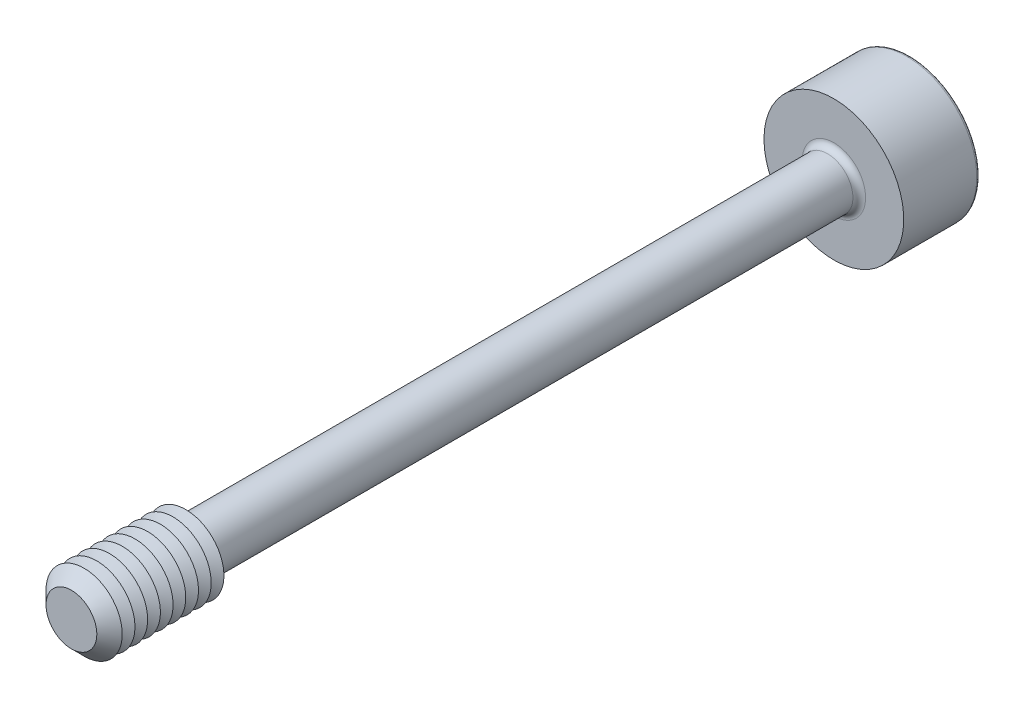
SolidWorks part; units mm, degrees
ref_plane "Front Plane" through (0, 0, 0) normal (0, 0, 1) x (1, 0, 0)
ref_plane "Top Plane" through (0, 0, 0) normal (0, 1, 0) x (1, 0, 0)
ref_plane "Right Plane" through (0, 0, 0) normal (1, 0, 0) x (0, 0, -1)
sketch "Sketch1" plane through (0, 0, 0) normal (0, 0, 1) x (1, 0, 0)
  circle A0 centre (0, 0) radius 1
  dimension "D1" = 2
extrude "Extrude1" add sketch "Sketch1" along normal mid plane 30
sketch "Sketch2" plane through (0, 0, 0) normal (1, 0, 0) x (0, 0, -1)
  line L0 (-15, 0) -> (-15, 1.5)
  line L1 (-15, 1) -> (-15, -1) construction
  line L2 (-15, 1.5) -> (-10.5, 1.5)
  line L3 (-10.5, 1.5) -> (-10.2113, 1)
  line L4 (15, 1) -> (-15, 1) construction
  line L5 (-10.2113, 1) -> (-10.2113, 0)
  line L6 (-10.2113, 0) -> (-15, 0)
  dimension "D1" = 1.5
  dimension "D2" = 120
  dimension "D3" = 4.5
revolve "Revolve1" add sketch "Sketch2" angle 360 about L6
chamfer "Chamfer1" distance 0.5 angle 45 1 edges at (0, 1.5, 15)
sketch "Sketch3" plane through (0, 0, -15) normal (0, 0, -1) x (-1, 0, 0)
  circle A0 centre (0, 0) radius 2.75
  dimension "D1" = 5.5
extrude "Extrude2" add sketch "Sketch3" along normal blind 3
sketch "Sketch4" plane through (-13.7, 0, -18) normal (0, 0, 1) x (1, 0, 0)
  line L2 (12.9783, -1.25) -> (14.4217, -1.25)
  line L3 (14.4217, -1.25) -> (15.1434, 0)
  line L4 (15.1434, 0) -> (14.4217, 1.25)
  line L6 (14.4217, 1.25) -> (12.9783, 1.25)
  line L7 (12.9783, 1.25) -> (12.2566, 0)
  line L8 (12.2566, 0) -> (12.9783, -1.25)
  circle A0 centre (13.7, 0) radius 1.25 construction
  dimension "D1" = 2.5
extrude "Extrude3" cut sketch "Sketch4" along normal blind 2.5
fillet "Fillet1" radius 0.25 1 edges at (-1, 0, -15)
fillet "Fillet2" radius 0.125 1 edges at (-2.75, 0, -18)
sketch "Sketch5" plane through (0, 0, 0) normal (1, 0, 0) x (0, 0, -1)
  line L0 (15.5, 0) -> (15.5, -1.25)
  line L1 (15.5, -1.25) -> (14.7783, 0)
  line L2 (14.7783, 0) -> (15.5, 0)
  dimension "D1" = 30
revolve "Cut-Revolve1" cut sketch "Sketch5" angle 360 about L2
sketch "Sketch6" plane through (0, 0, 0) normal (1, 0, 0) x (0, 0, -1)
  line L0 (1.332, 0) -> (-13.289, 0) construction
sketch "Sketch7" plane through (0, 0, 0) normal (1, 0, 0) x (0, 0, -1)
  line L0 (-10.5, 1.5) -> (-10.75, 1.067)
  line L1 (-10.75, 1.067) -> (-11, 1.5)
  line L2 (-10.5, 1.5) -> (-14.5, 1.5) construction
  line L3 (-11, 1.5) -> (-10.5, 1.5)
  dimension "D1" = 0.5
revolve "Cut-Revolve2" cut sketch "Sketch7" angle 360 about L0
pattern_linear "LPattern1" count 8 spacing 0.5 along (0, 0, 1) of "Cut-Revolve2"
